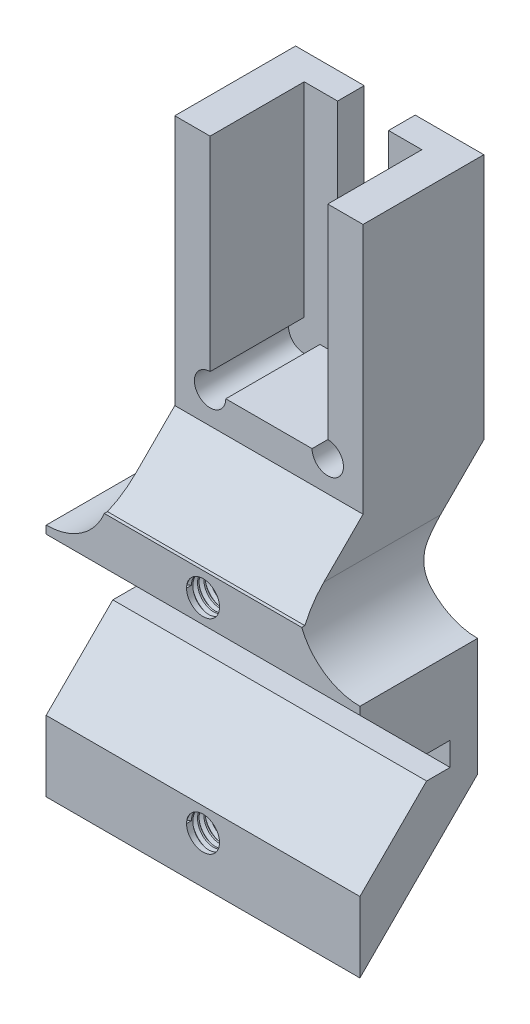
SolidWorks part; units mm, degrees
ref_plane "Front Plane" through (0, 0, 0) normal (0, 0, 1) x (1, 0, 0)
ref_plane "Top Plane" through (0, 0, 0) normal (0, 1, 0) x (1, 0, 0)
ref_plane "Right Plane" through (0, 0, 0) normal (1, 0, 0) x (0, 0, -1)
sketch "Sketch1" plane through (0, 0, 0) normal (0, 0, 1) x (1, 0, 0)
  line L0 (0, 27.8843) -> (0, -30.9534) construction
  line L1 (-12, 48.6063) -> (12, 48.6063)
  line L2 (12, 48.6063) -> (12, 3.6063)
  line L3 (12, 3.6063) -> (20, 3.6063)
  line L4 (20, 3.6063) -> (20, -26.3937)
  line L5 (20, -26.3937) -> (-20, -26.3937)
  line L6 (-20, -26.3937) -> (-20, 3.6063)
  line L7 (-20, 3.6063) -> (-12, 3.6063)
  line L8 (-12, 3.6063) -> (-12, 48.6063)
  dimension "D1" = 24
  dimension "D2" = 12
  dimension "D3" = 75
  dimension "D4" = 40
  dimension "D5" = 20
  dimension "D6" = 30
  dimension "D7" = 30
  dimension "D8" = 45
extrude "Boss-Extrude1" add sketch "Sketch1" along normal blind 23.8
sketch "Sketch2" plane through (0, 0, 0) normal (0, 0, -1) x (-1, 0, 0)
  line L1 (-20, 3.6063) -> (20, 3.6063)
  line L2 (-20, 3.6063) -> (-20, -26.3937)
  line L3 (-20, -26.3937) -> (20, -26.3937)
  line L4 (20, 3.6063) -> (20, -26.3937)
extrude "Cut-Extrude1" cut sketch "Sketch2" against normal blind 8.8
sketch "Sketch3" plane through (0, 0, 0) normal (0, 0, -1) x (-1, 0, 0)
  line L0 (-12, 3.6063) -> (-12, 48.6063) construction
  line L1 (-12, 18.3463) -> (12, 18.3463)
  line L2 (-12, 18.3463) -> (-12, 3.6063)
  line L3 (-12, 3.6063) -> (12, 3.6063)
  line L4 (12, 18.3463) -> (12, 3.6063)
  line L5 (-12, 48.6063) -> (12, 48.6063) construction
  dimension "D1" = 30.26
extrude "Cut-Extrude2" cut sketch "Sketch3" against normal blind 8.8
sketch "Sketch4" plane through (0, 0, 23.8) normal (0, 0, 1) x (1, 0, 0)
  line L0 (12, 3.6063) -> (12, 48.6063) construction
  line L1 (-12, 48.6063) -> (12, 48.6063)
  line L2 (-12, 48.6063) -> (-12, 8.6063)
  line L3 (-12, 8.6063) -> (12, 8.6063)
  line L4 (12, 48.6063) -> (12, 8.6063)
  dimension "D1" = 40
extrude "Cut-Extrude3" cut sketch "Sketch4" against normal blind 8.4
sketch "Sketch12" plane through (-20, 0, 0) normal (-1, 0, 0) x (0, 0, 1)
  line L0 (23.8, 2.6063) -> (15.3, -5.8937)
  line L1 (23.8, 3.6063) -> (23.8, -26.3937) construction
  line L2 (15.3, -8.8937) -> (23.8, -17.3937)
  line L4 (23.8, 3.6063) -> (8.8, 3.6063) construction
  line L5 (23.8, -26.3937) -> (8.8, -26.3937) construction
  line L6 (12.3, 0.8898) -> (12.3, -14.6864) construction
  line L7 (23.8, 2.6063) -> (23.8, -17.3937)
  line L8 (12.3, -5.8937) -> (15.3, -5.8937)
  line L9 (12.3, -5.8937) -> (12.3, -8.8937)
  line L10 (12.3, -8.8937) -> (15.3, -8.8937)
  line L12 (8.8, -26.3937) -> (8.8, 3.6063) construction
  line L13 (8.8, -11.3937) -> (23.8, -26.3937)
  line L14 (8.8, -11.3937) -> (8.8, -26.3937)
  line L15 (8.8, -26.3937) -> (23.8, -26.3937)
  dimension "D1" = 90
  dimension "D2" = 20
  dimension "D3" = 1
  dimension "D4" = 9
  dimension "D5" = 3.5
  dimension "D6" = 3
extrude "Cut-Extrude8" cut sketch "Sketch12" against normal through all
fillet "Fillet5" radius 8 2 edges at (12, 3.6063, 16.3) (-12, 3.6063, 16.3)
chamfer "Chamfer1" distance 8 angle 45 1 edges at (0, 8.6063, 15.4)
chamfer "Chamfer2" distance 10 angle 45 2 edges at (0, 18.3463, 0) (0, 18.3463, 8.8)
fillet "Fillet7" radius 5 1 edges at (0, 8.3463, 8.8)
sketch "Sketch13" plane through (0, 0, 15.4) normal (0, 0, 1) x (1, 0, 0)
  line L0 (0, 48.6063) -> (0, 30.2757) construction
  line L1 (12, 48.6063) -> (-12, 48.6063) construction
  line L3 (-7.5, 48.6063) -> (7.5, 48.6063)
  line L4 (-7.5, 48.6063) -> (-7.5, 20.6063)
  line L5 (-7.5, 20.6063) -> (7.5, 20.6063)
  line L6 (7.5, 48.6063) -> (7.5, 20.6063)
  dimension "D1" = 15
  dimension "D2" = 7.5
  dimension "D3" = 28
  dimension "D4" = 0
extrude "Cut-Extrude9" cut sketch "Sketch13" against normal blind 12
sketch "Sketch15" plane through (0, 0, 0) normal (0, 0, -1) x (-1, 0, 0)
  line L1 (-12, 48.6063) -> (12, 48.6063) construction
  line L2 (-3.25, 48.6063) -> (-3.25, 26.6063)
  line L3 (-3.25, 48.6063) -> (3.25, 48.6063)
  line L4 (3.25, 26.6063) -> (3.25, 48.6063)
  arc A0 (-3.25, 26.6063) -> (3.25, 26.6063) centre (0, 26.6063) ccw
  dimension "D1" = 22
  dimension "D2" = 6.5
extrude "Cut-Extrude10" cut sketch "Sketch15" against normal through all
sketch "Sketch16" plane through (0, 0, 15.4) normal (0, 0, 1) x (1, 0, 0)
  circle A0 centre (-7.5, 20.6063) radius 2
  circle A1 centre (7.5, 20.6063) radius 2
  dimension "D1" = 4
  dimension "D2" = 4
extrude "Cut-Extrude11" cut sketch "Sketch16" against normal up to surface (12 mm away)
sketch "Sketch17" plane through (0, 0, 23.8) normal (0, 0, 1) x (1, 0, 0)
  line L0 (-20, -17.3937) -> (-20, -26.3937) construction
  line L1 (-20, -5.8937) -> (-20, -8.8937) construction
  line L2 (-20, -7.3937) -> (20, -7.3937) construction
  line L3 (20, -5.8937) -> (20, -8.8937) construction
  point P0 (0, -20.3937)
  point P1 (0, 5.6063)
  dimension "D1" = 26
  dimension "D2" = 20
  dimension "D3" = 13
hole_wizard "M5x0.8 Tapped Hole1" positions "Sketch17" profile "Sketch18" tap size "M5x0.8" standard "ANSI Metric"
sketch "Sketch18" plane through (0, -20.3937, 23.8) normal (1, 0, 0) x (0, -1, 0)
  line L0 (0, 0) -> (0, 23.8)
  line L1 (0, 23.8) -> (2.1, 23.8)
  line L2 (2.1, 23.8) -> (2.1, 0)
  line L5 (2.1, 0) -> (0, 0)
  line L11 (0, -6.35) -> (0, 107.95) construction
  dimension "Thru Tap Drill Dia." = 4.2
  dimension "Thru Tap Drill Depth" = 23.8
thread "Thread1" pitch 0.8 start angle 0, offset 0, length 50, pitch 0.8, diameter 4.2
ref_plane "Plane1" through (-2.1, 5.6063, 23.8) normal (0, -1, 0) x (-1, 0, 0)
sketch "Thread Profile1" plane through (-2.1, 5.6063, 23.8) normal (0, -1, 0) x (-1, 0, 0)
  line L0 (0, 0) -> (0, 0.8) construction
  line L1 (0, 0) -> (0.433, 0.25)
  line L2 (0.433, 0.25) -> (0.433, 0.35)
  line L3 (0.433, 0.35) -> (0, 0.6)
  line L4 (0.433, 0.3) -> (0, 0.3) construction
  line L11 (0, 0) -> (0, 0.6)
  point P2 (0, 0)
  dimension "Pitch" = 0.8
  dimension "Profile_Angle" = 60
  dimension "Profile_Land" = 0.1
  dimension "Profile_Height" = 0.433
thread "Thread2" pitch 0.8 start angle 0, offset 0, length 50, pitch 0.8, diameter 4.2
ref_plane "Plane2" through (-2.1, -20.3937, 23.8) normal (0, -1, 0) x (-1, 0, 0)
sketch "Thread Profile2" plane through (-2.1, -20.3937, 23.8) normal (0, -1, 0) x (-1, 0, 0)
  line L0 (0, 0) -> (0, 0.8) construction
  line L1 (0, 0) -> (0.433, 0.25)
  line L2 (0.433, 0.25) -> (0.433, 0.35)
  line L3 (0.433, 0.35) -> (0, 0.6)
  line L4 (0.433, 0.3) -> (0, 0.3) construction
  line L11 (0, 0) -> (0, 0.6)
  point P2 (0, 0)
  dimension "Pitch" = 0.8
  dimension "Profile_Angle" = 60
  dimension "Profile_Land" = 0.1
  dimension "Profile_Height" = 0.433
